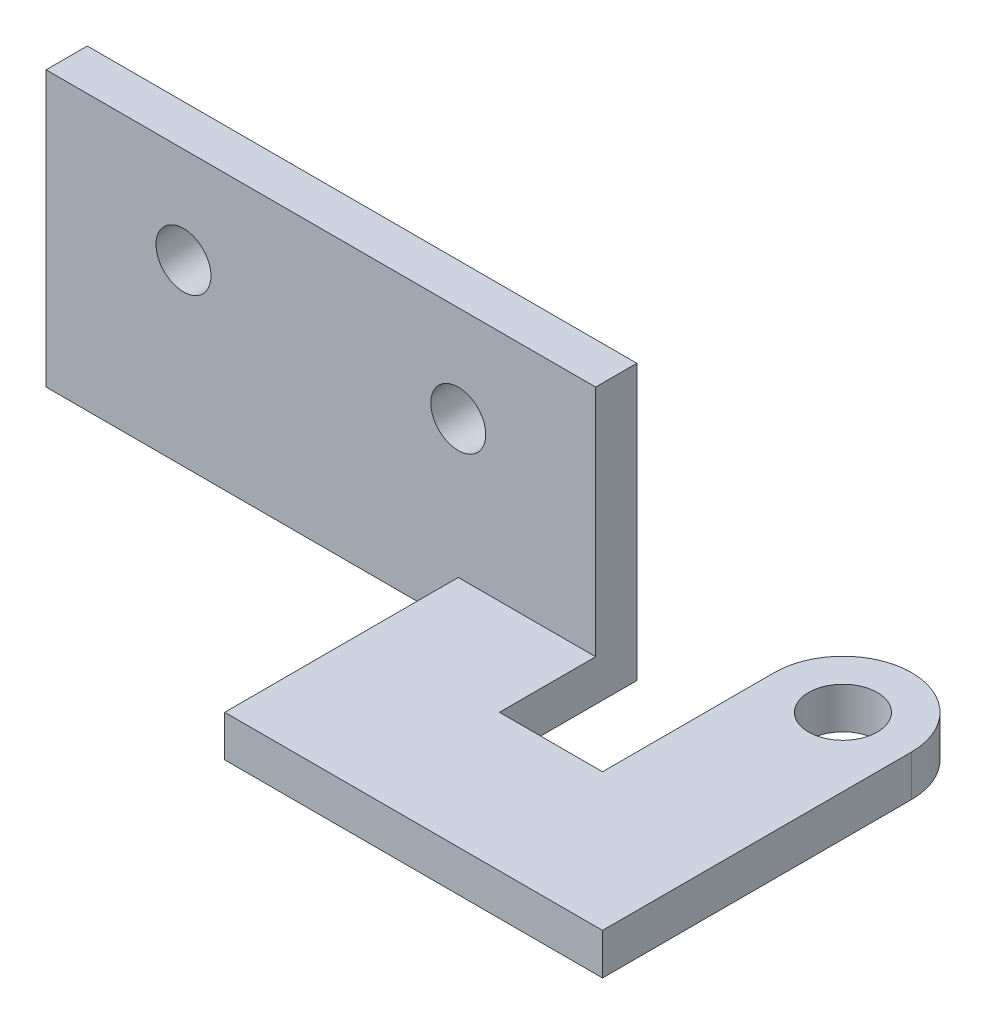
SolidWorks part; units mm, degrees
ref_plane "Ebene vorne" through (0, 0, 0) normal (0, 0, 1) x (1, 0, 0)
ref_plane "Ebene oben" through (0, 0, 0) normal (0, 1, 0) x (1, 0, 0)
ref_plane "Ebene rechts" through (0, 0, 0) normal (1, 0, 0) x (0, 0, -1)
sketch "Skizze1" plane through (0, 0, 0) normal (0, 0, 1) x (1, 0, 0)
  line L1 (0, 0) -> (40, 0)
  line L2 (0, 0) -> (0, 20)
  line L3 (0, 20) -> (40, 20)
  line L4 (40, 0) -> (40, 20)
  circle A0 centre (10, 13) radius 2
  circle A1 centre (30, 13) radius 2
  dimension "D6" = 4
  dimension "D7" = 4
  dimension "D1" = 40
  dimension "D2" = 20
  dimension "D3" = 10
  dimension "D4" = 20
  dimension "D5" = 13
  dimension "D8" = 13
extrude "Aufsatz-Linear austragen1" add sketch "Skizze1" along normal blind 3
sketch "Skizze2" plane through (0, 0, 0) normal (0, -1, 0) x (1, 0, 0)
  line L0 (40, 0) -> (40, 10)
  line L1 (40, 10) -> (47.5, 10)
  line L2 (47.5, 10) -> (47.5, -7.5)
  line L3 (47.5, -7.5) -> (57.5, -7.5)
  line L4 (57.5, -7.5) -> (57.5, 20)
  line L5 (57.5, 20) -> (30, 20)
  line L6 (30, 20) -> (30, 0)
  line L7 (0, 0) -> (40, 0) construction
  line L8 (30, 0) -> (40, 0)
  circle A0 centre (52.5, -2.5) radius 2.5
  dimension "D9" = 5
  dimension "D1" = 10
  dimension "D2" = 10
  dimension "D3" = 20
  dimension "D4" = 27.5
  dimension "D5" = 10
  dimension "D6" = 27.5
  dimension "D7" = 5
  dimension "D8" = 5
extrude "Aufsatz-Linear austragen2" add sketch "Skizze2" against normal blind 3
fillet "Verrundung1" radius 5 2 edges at (57.5, 1.5, -7.5) (47.5, 1.5, -7.5)
